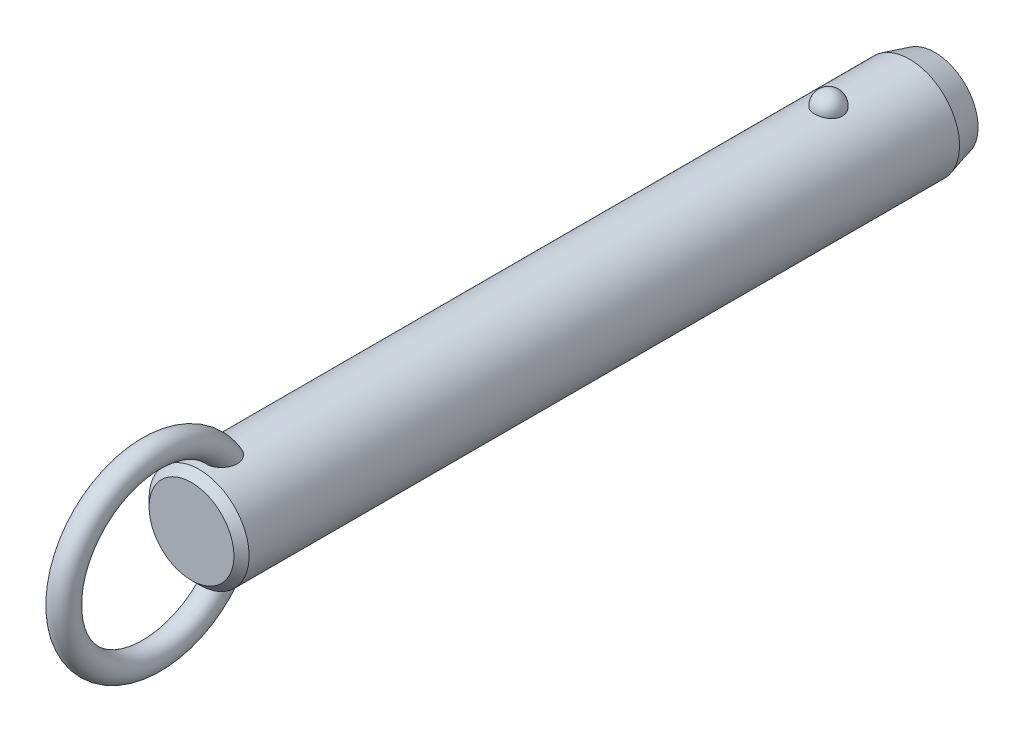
SolidWorks part; units mm, degrees
ref_plane "Front Plane" through (0, 0, 0) normal (0, 0, 1) x (1, 0, 0)
ref_plane "Top Plane" through (0, 0, 0) normal (0, 1, 0) x (1, 0, 0)
ref_plane "Right Plane" through (0, 0, 0) normal (1, 0, 0) x (0, 0, -1)
sketch "Sketch2" plane through (0, 0, 0) normal (0, 0, 1) x (1, 0, 0)
  circle A0 centre (0, 0) radius 7.9
  point P3 (0, 7.9)
  dimension "D1" = 15.8
extrude "Boss-Extrude1" add sketch "Sketch2" along normal blind 88.9
sketch "Sketch3" plane through (0, 0, 0) normal (0, 0, -1) x (-1, 0, 0)
  circle A0 centre (0, 0) radius 7.9
  dimension "D1" = 15.8
extrude "Boss-Extrude2" add sketch "Sketch3" along normal blind 19
chamfer "Chamfer1" distance 4 angle 15 1 edges at (-7.9, 0, -19)
sketch "Sketch12" plane through (0, 0, 0) normal (1, 0, 0) x (0, 0, -1)
  line L0 (-88.9, 7.9) -> (-88.9, -7.9) construction
  point P0 (-88.9, 0)
sketch "Sketch13" plane through (0, 0, 0) normal (1, 0, 0) x (0, 0, -1)
  circle A0 centre (-104.75, 0) radius 15.85
  point P2 (-88.9, 0)
  dimension "D1" = 31.7
sketch "Sketch14" plane through (0, 0, 0) normal (0, 1, 0) x (1, 0, 0)
  circle A0 centre (0, -90.9) radius 2
  point P2 (0, -88.9)
  dimension "D1" = 4
sweep "Sweep1" add profiles "Sketch14" path "Sketch13"
sketch "Sketch15" plane through (0, 0, 88.9) normal (0, 0, 1) x (1, 0, 0)
  circle A0 centre (0, 0) radius 7.9
  dimension "D1" = 15.8
extrude "Boss-Extrude3" add sketch "Sketch15" along normal blind 9.52
chamfer "Chamfer2" distance 1.2 angle 45 1 edges at (7.9, 0, 98.42)
sketch "Sketch18" plane through (0, 0, 0) normal (1, 0, 0) x (0, 0, -1)
  line L0 (15, 7.9) -> (-91.0091, 7.9) construction
  line L1 (2.2, 10.1) -> (2.2, 5.7)
  line L2 (-91.0091, -7.9) -> (15, -7.9) construction
  arc A0 (2.2, 10.1) -> (2.2, 5.7) centre (2.2, 7.9) ccw
  point P4 (0, 7.9)
  dimension "D1" = 18
revolve "Revolve1" add sketch "Sketch18" angle 360 about L1
